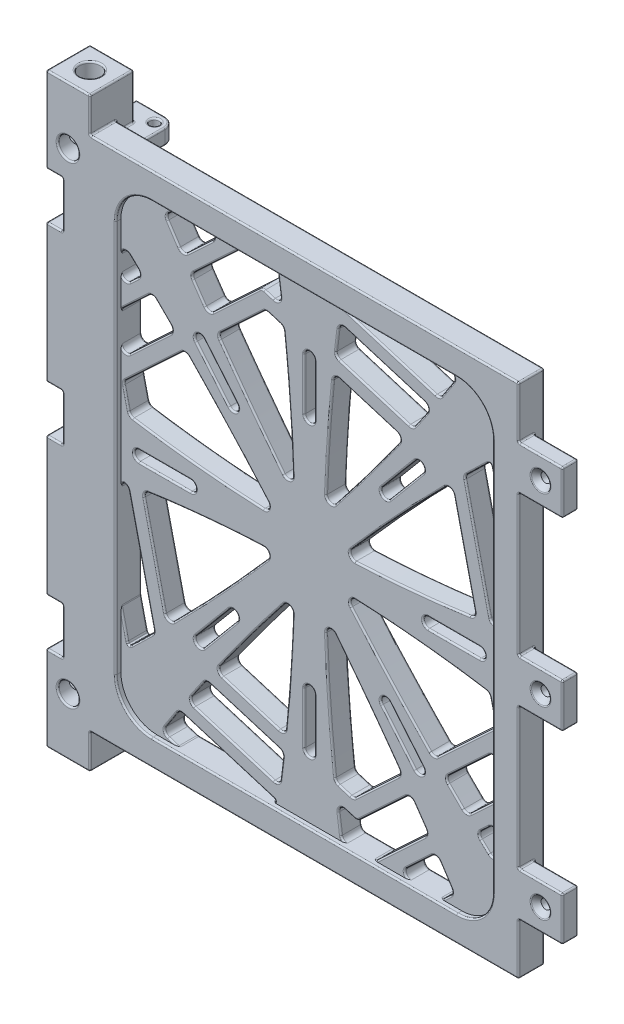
SolidWorks part; units mm, degrees
ref_plane "Front Plane" through (0, 0, 0) normal (0, 0, 1) x (1, 0, 0)
ref_plane "Top Plane" through (0, 0, 0) normal (0, 1, 0) x (1, 0, 0)
ref_plane "Right Plane" through (0, 0, 0) normal (1, 0, 0) x (0, 0, -1)
imported_body "Stock-cubesat - Master-1"
sketch "Sketch1" plane through (0, 0, 50) normal (0, 0, 1) x (1, 0, 0)
  line L1 (18.1879, 28.5582) -> (4.7082, 32.6747)
  line L2 (-8.4861, 36.704) -> (-17.801, 28.0122)
  line L3 (-36.0296, 11.0028) -> (-34.8308, 5.8177)
  line L4 (-18.1963, -28.5556) -> (-4.7082, -32.6747)
  line L5 (8.4861, -36.704) -> (17.8072, -28.0063)
  line L6 (36.0296, -11.0028) -> (34.8308, -5.8177)
  line L7 (-9.2664, 40.0791) -> (-19.5451, 30.4879)
  line L8 (-35.2057, -5.8787) -> (-30.0497, -28.1793)
  line L10 (9.2664, -40.0791) -> (19.5509, -30.4825)
  line L11 (35.2057, 5.8787) -> (30.0483, 28.1857)
  line L12 (35.1418, 32.7911) -> (34.8858, 32.8693)
  line L13 (-12.7874, 45) -> (-22.9852, 35.4843)
  line L14 (-36.5, -26.9164) -> (-35.1418, -32.7911)
  line L15 (-35.1418, -32.7911) -> (-34.8895, -32.8681)
  line L16 (12.7874, -45) -> (22.9898, -35.48)
  line L17 (-35.1418, -32.7911) -> (10.8271, -46.8292) construction
  line L19 (-25.3624, -45) -> (-6.24, -45)
  line L20 (-36.5, -26.9164) -> (-36.5, -6.0942)
  line L21 (-25.7161, 45) -> (-16.9223, 45)
  line L22 (36.5, -34.3959) -> (36.5, -26.7286)
  line L23 (-10.8271, 46.8292) -> (-45.9688, 14.0381) construction
  line L24 (35.1418, 32.7911) -> (-10.8271, 46.8292) construction
  line L26 (10.8271, -46.8292) -> (45.9688, -14.0381) construction
  line L27 (9.2664, -40.0791) -> (39.3427, -12.0146) construction
  line L28 (39.3427, -12.0146) -> (30.0763, 28.0645) construction
  line L29 (36.5, 26.9164) -> (35.1418, 32.7911)
  line L30 (45.9688, -14.0381) -> (35.1418, 32.7911) construction
  line L31 (-45.9688, 14.0381) -> (-35.1418, -32.7911) construction
  line L32 (-39.3427, 12.0146) -> (-30.0763, -28.0645) construction
  line L33 (-9.2664, 40.0791) -> (-39.3427, 12.0146) construction
  line L34 (-32.2342, -5.4132) -> (-27.5453, -25.6936)
  line L35 (-36.0296, 11.0028) -> (-27.5436, -25.7012) construction
  line L36 (-36.5, 14.6671) -> (-36.5, 22.8735)
  line L37 (32.2342, 5.4132) -> (27.5436, 25.7012)
  line L38 (36.0296, -11.0028) -> (27.5436, 25.7012) construction
  line L39 (36.5, 6.0942) -> (36.5, 26.9164)
  line L40 (24.0639, -22.1682) -> (36.0296, -11.0028)
  line L41 (8.4861, -36.704) -> (36.0296, -11.0028) construction
  line L42 (26.1676, -24.3084) -> (36.5, -14.6671)
  line L43 (30.4219, -28.5451) -> (36.5, -22.8735)
  line L44 (5.0334, -35.6496) -> (8.4861, -36.704)
  line L45 (-27.5436, -25.7012) -> (8.4861, -36.704) construction
  line L46 (5.4218, -38.905) -> (9.2664, -40.0791)
  line L47 (-30.0763, -28.0645) -> (9.2664, -40.0791) construction
  line L48 (6.24, -45) -> (12.7874, -45)
  line L49 (-20.0086, -31.139) -> (-5.0403, -35.71)
  line L50 (-23.5624, -36.3273) -> (-5.7895, -41.7548)
  line L51 (-30.4179, 28.5488) -> (-36.5, 22.8735)
  line L52 (-26.1624, 24.3132) -> (-36.5, 14.6671)
  line L53 (-24.0581, 22.1736) -> (-36.0296, 11.0028)
  line L54 (-8.4861, 36.704) -> (-36.0296, 11.0028) construction
  line L56 (-5.4218, 38.905) -> (-9.2664, 40.0791)
  line L57 (30.0763, 28.0645) -> (-9.2664, 40.0791) construction
  line L58 (-5.0334, 35.6496) -> (-8.4861, 36.704)
  line L59 (27.5436, 25.7012) -> (-8.4861, 36.704) construction
  line L60 (23.5565, 36.329) -> (5.7895, 41.7548)
  line L61 (20.001, 31.1413) -> (5.0403, 35.71)
  line L62 (-13.1261, 56.75) -> (-55.71, 17.0075) construction
  line L63 (-11.5648, 50) -> (-49.0837, 14.9846) construction
  line L64 (-25.7161, 45) -> (-27.9255, 42.938)
  line L65 (-16.9223, 45) -> (-24.5799, 37.8533)
  line L66 (16.9223, -45) -> (25.7161, -45)
  line L67 (-25.2007, -38.776) -> (-6.1802, -44.5827)
  line L68 (16.9223, -45) -> (24.5838, -37.8497)
  line L69 (13.1261, -56.75) -> (55.71, -17.0075) construction
  line L70 (25.1958, 38.7775) -> (6.1802, 44.5827)
  line L71 (36.5, -22.8735) -> (36.5, -14.6671)
  line L72 (-28.6184, -44.006) -> (-25.3624, -45)
  line L73 (25.7161, -45) -> (27.9279, -42.9358)
  line L74 (11.5648, -50) -> (49.0837, -14.9846) construction
  line L75 (28.6156, 44.0068) -> (25.3624, 45)
  line L76 (37.5189, 35.0154) -> (-11.5648, 50) construction
  line L77 (42.5839, 39.7425) -> (-13.1261, 56.75) construction
  line L78 (-37.5189, -35.0154) -> (11.5648, -50) construction
  line L79 (-42.5839, -39.7425) -> (13.1261, -56.75) construction
  line L80 (25.3624, 45) -> (6.24, 45)
  line L81 (55.71, -17.0075) -> (42.5839, 39.7425) construction
  line L82 (49.0837, -14.9846) -> (37.5189, 35.0154)
  line L83 (49.0837, -14.9846) -> (37.5189, 35.0154) construction
  line L84 (32.4422, -30.5157) -> (36.5, -26.7286)
  line L85 (-49.0837, 14.9846) -> (-37.5189, -35.0154)
  line L86 (-49.0837, 14.9846) -> (-37.5189, -35.0154) construction
  line L87 (-55.71, 17.0075) -> (-42.5839, -39.7425) construction
  line L88 (-36.5, 26.7286) -> (-36.5, 34.3995)
  line L89 (-32.4389, 30.5188) -> (-36.5, 26.7286)
  line L90 (-12.7874, 45) -> (-6.24, 45)
  spline S0 degree 3 poles (6.24, -45) (5.9474, -42.9683) (5.6747, -40.9366) (5.4218, -38.905) knots 0.05 0.05 0.05 0.05 0.11095 0.11095 0.11095 0.11095
  spline S1 degree 3 poles (-6.24, -45) (-6.22, -44.8609) (-6.2, -44.7218) (-6.1802, -44.5827) knots 0.05 0.05 0.05 0.05 0.054173 0.054173 0.054173 0.054173
  spline S2 degree 3 poles (34.8308, -5.8177) (25.4091, -4.2933) (15.9875, -3.3875) (6.5658, -3.1001) knots 0.080352 0.080352 0.080352 0.080352 0.420894 0.420894 0.420894 0.420894
  spline S3 degree 3 poles (26.1676, -24.3084) (27.5748, -25.7297) (28.9928, -27.142) (30.4219, -28.5451) knots 0.817381 0.817381 0.817381 0.817381 0.869043 0.869043 0.869043 0.869043
  spline S4 degree 3 poles (28.6156, 44.0068) (27.4875, 42.2539) (26.3475, 40.5108) (25.1958, 38.7775) knots 0.060746 0.060746 0.060746 0.060746 0.114386 0.114386 0.114386 0.114386
  spline S5 degree 3 poles (34.8858, 32.8693) (33.2595, 31.3195) (31.647, 29.7583) (30.0483, 28.1857) knots 0.077551 0.077551 0.077551 0.077551 0.135404 0.135404 0.135404 0.135404
  spline S6 degree 3 poles (3.1169, 8.5481) (3.3369, 16.5903) (3.8673, 24.6325) (4.7082, 32.6747) knots 0.585481 0.585481 0.585481 0.585481 0.826747 0.826747 0.826747 0.826747
  spline S7 degree 3 poles (-6.5497, 3.0996) (-15.9767, 3.3864) (-25.4038, 4.2925) (-34.8308, 5.8177) knots 0.578912 0.578912 0.578912 0.578912 0.919648 0.919648 0.919648 0.919648
  spline S8 degree 3 poles (-3.1169, 8.5481) (-3.364, 17.582) (-4.0029, 26.6158) (-5.0334, 35.6496) knots 0.585481 0.585481 0.585481 0.585481 0.856496 0.856496 0.856496 0.856496
  spline S9 degree 3 poles (-6.5658, -3.1001) (-15.1219, -3.3611) (-23.678, -4.1321) (-32.2342, -5.4132) knots 0.579106 0.579106 0.579106 0.579106 0.888364 0.888364 0.888364 0.888364
  spline S10 degree 3 poles (-3.1164, -8.5284) (-8.3357, -15.0438) (-13.3623, -21.7196) (-18.1963, -28.5556) knots 0.562618 0.562618 0.562618 0.562618 0.779016 0.779016 0.779016 0.779016
  spline S11 degree 3 poles (-6.5658, -3.1001) (-13.2687, -10.873) (-20.2619, -18.4041) (-27.5453, -25.6936) knots 0.568139 0.568139 0.568139 0.568139 0.834199 0.834199 0.834199 0.834199
  spline S12 degree 3 poles (6.5658, -3.1001) (12.1938, -9.6265) (18.0265, -15.9826) (24.0639, -22.1682) knots 0.568139 0.568139 0.568139 0.568139 0.791535 0.791535 0.791535 0.791535
  spline S13 degree 3 poles (3.1164, -8.5284) (8.1958, -14.8692) (13.0928, -21.3618) (17.8072, -28.0063) knots 0.562618 0.562618 0.562618 0.562618 0.773216 0.773216 0.773216 0.773216
  spline S14 degree 3 poles (-36.5, 34.3995) (-35.1367, 33.1139) (-33.783, 31.8203) (-32.4389, 30.5188) knots 0.058463 0.058463 0.058463 0.058463 0.106691 0.106691 0.106691 0.106691
  spline S15 degree 3 poles (-27.9255, 42.938) (-26.8215, 41.2338) (-25.7063, 39.5389) (-24.5799, 37.8533) knots 0.07166 0.07166 0.07166 0.07166 0.123929 0.123929 0.123929 0.123929
  spline S16 degree 3 poles (36.5, 6.0942) (36.0686, 6.0211) (35.6371, 5.9492) (35.2057, 5.8787) knots 0.060241 0.060241 0.060241 0.060241 0.075835 0.075835 0.075835 0.075835
  spline S17 degree 3 poles (19.5509, -30.4825) (20.7084, -32.139) (21.8547, -33.8049) (22.9898, -35.48) knots 0.799303 0.799303 0.799303 0.799303 0.851511 0.851511 0.851511 0.851511
  spline S18 degree 3 poles (5.0334, -35.6496) (4.0021, -26.6092) (3.3631, -17.5688) (3.1164, -8.5284) knots 0.143504 0.143504 0.143504 0.143504 0.414716 0.414716 0.414716 0.414716
  spline S19 degree 3 poles (-4.7082, -32.6747) (-3.8666, -24.6259) (-3.336, -16.5771) (-3.1164, -8.5284) knots 0.173253 0.173253 0.173253 0.173253 0.414716 0.414716 0.414716 0.414716
  spline S20 degree 3 poles (-20.0086, -31.139) (-21.2052, -32.8584) (-22.3898, -34.5878) (-23.5624, -36.3273) knots 0.806194 0.806194 0.806194 0.806194 0.860304 0.860304 0.860304 0.860304
  spline S21 degree 3 poles (-30.0497, -28.1793) (-31.6493, -29.7537) (-33.2625, -31.3166) (-34.8895, -32.8681) knots 0.864556 0.864556 0.864556 0.864556 0.922459 0.922459 0.922459 0.922459
  spline S22 degree 3 poles (-35.2057, -5.8787) (-35.6371, -5.9492) (-36.0686, -6.0211) (-36.5, -6.0942) knots 0.924165 0.924165 0.924165 0.924165 0.939759 0.939759 0.939759 0.939759
  spline S23 degree 3 poles (-24.0581, 22.1736) (-18.0165, 15.9866) (-12.1803, 9.6286) (-6.5497, 3.0996) knots 0.208454 0.208454 0.208454 0.208454 0.431942 0.431942 0.431942 0.431942
  spline S24 degree 3 poles (-17.801, 28.0122) (-13.0879, 21.3729) (-8.1933, 14.8849) (-3.1169, 8.5481) knots 0.226773 0.226773 0.226773 0.226773 0.437237 0.437237 0.437237 0.437237
  spline S25 degree 3 poles (-5.4218, 38.905) (-5.6747, 40.9366) (-5.9474, 42.9683) (-6.24, 45) knots 0.88905 0.88905 0.88905 0.88905 0.95 0.95 0.95 0.95
  spline S26 degree 3 poles (5.0403, 35.71) (5.2706, 37.7249) (5.5203, 39.7399) (5.7895, 41.7548) knots 0.8571 0.8571 0.8571 0.8571 0.917548 0.917548 0.917548 0.917548
  spline S27 degree 3 poles (18.1879, 28.5582) (13.356, 21.7286) (8.3323, 15.0585) (3.1169, 8.5481) knots 0.221007 0.221007 0.221007 0.221007 0.437237 0.437237 0.437237 0.437237
  spline S28 degree 3 poles (27.5436, 25.7012) (20.2541, 18.4099) (13.2561, 10.876) (6.5497, 3.0996) knots 0.165754 0.165754 0.165754 0.165754 0.431942 0.431942 0.431942 0.431942
  spline S29 degree 3 poles (32.2342, 5.4132) (23.6727, 4.1313) (15.1112, 3.3601) (6.5497, 3.0996) knots 0.111636 0.111636 0.111636 0.111636 0.421088 0.421088 0.421088 0.421088
  spline S30 degree 3 poles (23.5565, 36.329) (22.3834, 34.5898) (21.1982, 32.8605) (20.001, 31.1413) knots 0.139712 0.139712 0.139712 0.139712 0.193826 0.193826 0.193826 0.193826
  spline S31 degree 3 poles (6.1802, 44.5827) (6.2, 44.7218) (6.22, 44.8609) (6.24, 45) knots 0.945827 0.945827 0.945827 0.945827 0.95 0.95 0.95 0.95
  spline S32 degree 3 poles (24.5838, -37.8497) (25.7098, -39.5357) (26.8245, -41.2311) (27.9279, -42.9358) knots 0.876064 0.876064 0.876064 0.876064 0.928336 0.928336 0.928336 0.928336
  spline S33 degree 3 poles (-5.7895, -41.7548) (-5.5203, -39.7399) (-5.2706, -37.7249) (-5.0403, -35.71) knots 0.082452 0.082452 0.082452 0.082452 0.1429 0.1429 0.1429 0.1429
  spline S34 degree 3 poles (-25.2007, -38.776) (-26.3517, -40.5095) (-27.491, -42.2528) (-28.6184, -44.006) knots 0.885627 0.885627 0.885627 0.885627 0.939262 0.939262 0.939262 0.939262
  spline S35 degree 3 poles (32.4422, -30.5157) (33.7853, -31.817) (35.1379, -33.1104) (36.5, -34.3959) knots 0.893302 0.893302 0.893302 0.893302 0.941511 0.941511 0.941511 0.941511
  spline S36 degree 3 poles (-30.4179, 28.5488) (-28.9884, 27.1461) (-27.5699, 25.7342) (-26.1624, 24.3132) knots 0.130949 0.130949 0.130949 0.130949 0.182609 0.182609 0.182609 0.182609
  spline S37 degree 3 poles (-22.9852, 35.4843) (-21.8497, 33.8095) (-20.703, 32.1441) (-19.5451, 30.4879) knots 0.148481 0.148481 0.148481 0.148481 0.200686 0.200686 0.200686 0.200686
  point P43 (0, 0)
extrude "Cut-Extrude1" cut sketch "Sketch1" against normal blind 5
fillet "Fillet1" radius 1 92 edges at (-16.9223, 45, 47.5) (-5.0334, 35.6496, 47.5) (-6.24, 45, 47.5) (-27.9255, 42.938, 47.5) (-22.9852, 35.4843, 47.5) (5.0403, 35.71, 47.5) (6.1802, 44.5827, 47.5) (6.24, 45, 47.5) (26.1676, -24.3084, 47.5) (32.4422, -30.5157, 47.5) (17.8072, -28.0063, 47.5) (22.9898, -35.48, 47.5) (27.9279, -42.9358, 47.5) (9.2664, -40.0791, 47.5) (-25.2007, -38.776, 47.5) (-27.5453, -25.6936, 47.5) (-35.1418, -32.7911, 47.5) (-34.8895, -32.8681, 47.5) (-5.7895, -41.7548, 47.5) (-4.7082, -32.6747, 47.5) (36.5, -22.8735, 47.5) (24.0639, -22.1682, 47.5) (30.4219, -28.5451, 47.5) (36.5, -34.3959, 47.5) (25.7161, -45, 47.5) (12.7874, -45, 47.5) (8.4861, -36.704, 47.5) (-5.4218, 38.905, 47.5) (20.001, 31.1413, 47.5) (25.1958, 38.7775, 47.5) (36.0296, -11.0028, 47.5) (32.2342, 5.4132, 47.5) (36.5, 6.0942, 47.5) (35.2057, 5.8787, 47.5) (-36.5, 14.6671, 47.5) (-36.5, 26.7286, 47.5) (-32.4389, 30.5188, 47.5) (-26.1624, 24.3132, 47.5) (-17.801, 28.0122, 47.5) (-24.5799, 37.8533, 47.5) (-19.5451, 30.4879, 47.5) (-9.2664, 40.0791, 47.5) (-34.8308, 5.8177, 47.5) (-36.5, -26.9164, 47.5) (-25.3624, -45, 47.5) (-28.6184, -44.006, 47.5) (6.24, -45, 47.5) (16.9223, -45, 47.5) (5.0334, -35.6496, 47.5) (-18.1963, -28.5556, 47.5) (-23.5624, -36.3273, 47.5) (-20.0086, -31.139, 47.5) (-6.24, -45, 47.5) (-6.1802, -44.5827, 47.5) (-5.0403, -35.71, 47.5) (18.1879, 28.5582, 47.5) (23.5565, 36.329, 47.5) (28.6156, 44.0068, 47.5) (25.3624, 45, 47.5) (27.5436, 25.7012, 47.5) (36.5, 26.9164, 47.5) (35.1418, 32.7911, 47.5) (34.8858, 32.8693, 47.5) (34.8308, -5.8177, 47.5) (36.5, -14.6671, 47.5) (36.5, -26.7286, 47.5) (24.5838, -37.8497, 47.5) (19.5509, -30.4825, 47.5) (5.7895, 41.7548, 47.5) (-32.2342, -5.4132, 47.5) (-36.5, -6.0942, 47.5) (-36.0296, 11.0028, 47.5) (-36.5, 22.8735, 47.5) (-30.4179, 28.5488, 47.5) (-36.5, 34.3995, 47.5) (-25.7161, 45, 47.5) (-12.7874, 45, 47.5) (4.7082, 32.6747, 47.5) (-8.4861, 36.704, 47.5) (-24.0581, 22.1736, 47.5) (3.1164, -8.5284, 47.5) (6.5497, 3.0996, 47.5) (3.1169, 8.5481, 47.5) (-3.1169, 8.5481, 47.5) (-6.5497, 3.0996, 47.5) (-3.1164, -8.5284, 47.5) (-6.5658, -3.1001, 47.5) (6.5658, -3.1001, 47.5) (5.4218, -38.905, 47.5) (-35.2057, -5.8787, 47.5) (30.0483, 28.1857, 47.5) (-30.0497, -28.1793, 47.5)
fillet "Fillet5" radius 0.3 2 edges at (6.4482, 44.7521, 47.5) (-6.4482, -44.7521, 47.5)
sketch "Sketch4" plane through (0, 0, 50) normal (0, 0, 1) x (1, 0, 0)
  line L0 (-19.4594, 45) -> (-25.322, 45) construction
  line L1 (36.5, -45) -> (-36.5, -45)
  line L2 (36.5, -45) -> (36.5, 45)
  line L3 (36.5, 45) -> (-36.5, 45)
  line L4 (-36.5, -45) -> (-36.5, 45)
  line L5 (36.5, -45) -> (-36.5, 45) construction
  line L6 (36.5, 45) -> (-36.5, -45) construction
  line L7 (-36.5, -6.9406) -> (-36.5, -26.8023) construction
  point P0 (0, 0)
extrude "Cut-Extrude3" cut sketch "Sketch4" against normal blind 1
fillet "Fillet4" radius 7 4 edges at (-36.5, -45, 49.5) (36.5, -45, 49.5) (36.5, 45, 49.5) (-36.5, 45, 49.5)
fillet "Fillet3" radius 0.3 152 edges at (-39.5, -45, 45) (-39.5, 45, 45) (-42.25, -45, 37.5) (-38.0858, -45, 38.0858) (-42.25, 45, 37.5) (-38.0858, 45, 38.0858) (-48.4, -31.25, 50) (-48.4, -4.5, 50) (-48.4, 4.5, 50) (-48.4, 31.25, 50) (-48.4, 40.25, 50) (-48.4, -40.25, 50) (43.85, 35.75, 50) (43.85, 0, 50) (43.85, -35.75, 50) (-47.75, -45.75, 50) (-47.75, 45.75, 50) (-36.5, 0, 50) (36.5, 0, 50) (0, -45, 50) (0, 45, 50) (-39.5, -48, 40.4) (-42.25, -48, 37.5) (-45, -48, 39.5) (-39.5, -48, 45) (-38.0858, -48, 38.0858) (-39.5, 48, 45) (-45, 48, 39.5) (-42.25, 48, 37.5) (-38.0858, 48, 38.0858) (-39.5, 48, 40.4) (-41.5, 45, 43.25) (-41.5, -45, 43.25) (-41.5, 0, 45) (-41.5, 49, 45) (-41.5, -49, 45) (-41.5, 48, 43.25) (-37.5, -46.5, 45) (-37.5, -45, 42.25) (-37.5, -48, 42.25) (-37.5, 45, 42.25) (-37.5, 46.5, 45) (-37.5, 48, 42.25) (-43.25, 45, 41.5) (-45, 46.5, 41.5) (-43.25, 48, 41.5) (-41.5, 0, 41.5) (-41.5, -52.375, 41.5) (-41.5, 52.375, 41.5) (-48.4, 40.25, 41.5) (-48.4, 31.25, 41.5) (-48.4, 4.5, 41.5) (-48.4, -4.5, 41.5) (-48.4, -31.25, 41.5) (-48.4, -40.25, 41.5) (-43.25, -48, 41.5) (-45, -46.5, 41.5) (-43.25, -45, 41.5) (-41.5, -48, 43.25) (0, -50, 45) (45.75, 31.5, 47) (45.75, -4.25, 47) (45.75, -4.25, 50) (45.75, -40, 47) (45.75, -40, 50) (45.75, -31.5, 47) (45.75, -31.5, 50) (50, -31.5, 48.5) (50, -35.75, 47) (50, -40, 48.5) (50, -35.75, 50) (45.75, 4.25, 47) (45.75, 4.25, 50) (50, 4.25, 48.5) (50, 0, 47) (50, -4.25, 48.5) (50, 0, 50) (50, 35.75, 47) (50, 31.5, 48.5) (50, 35.75, 50) (45.75, 40, 47) (50, 40, 48.5) (41.5, 4.25, 48.5) (41.5, 35.75, 47) (41.5, 0, 45) (41.5, -50, 47.5) (41.5, -40, 48.5) (41.5, -35.75, 47) (41.5, -31.5, 48.5) (41.5, -4.25, 48.5) (41.5, 0, 47) (0, 50, 45) (41.5, 50, 47.5) (-45.75, -56.75, 50) (-41.5, -56.75, 45.75) (-45.75, -56.75, 41.5) (-45.75, -56.75, 47.75) (-50, -56.75, 45.75) (-50, -48.5, 41.5) (-50, -17.875, 41.5) (-50, 17.875, 41.5) (-50, 48.5, 41.5) (-50, -40.25, 45.75) (-50, -48.5, 50) (-50, 48.5, 50) (-50, 17.875, 50) (-50, -17.875, 50) (-50, -45.75, 43.75) (-46.8, -40.25, 45.75) (-46.8, -35.75, 41.5) (-46.8, -31.25, 45.75) (-46.8, -35.75, 50) (-46.8, -35.75, 46.65) (-50, -4.5, 45.75) (-50, -31.25, 45.75) (-46.8, -4.5, 45.75) (-46.8, 0, 41.5) (-46.8, 4.5, 45.75) (-46.8, 0, 50) (-46.8, 0, 44.85) (-46.8, 31.25, 45.75) (-46.8, 35.75, 41.5) (-46.8, 40.25, 45.75) (-46.8, 35.75, 50) (-46.8, 35.75, 46.65) (-50, 4.5, 45.75) (-50, 31.25, 45.75) (-50, 40.25, 45.75) (-50, 45.75, 47.75) (-45.75, 56.75, 41.5) (-41.5, 56.75, 45.75) (-45.75, 56.75, 50) (-50, 56.75, 45.75) (-45.75, 56.75, 47.75) (34.4497, -42.9497, 50) (34.4497, 42.9497, 50) (-34.4497, 42.9497, 50) (-34.4497, -42.9497, 50)
fillet "Fillet6" radius 0.3 11 edges at (6.8956, 44.3707, 45) (-33.6503, 25.5326, 45) (-35.8817, 10.9577, 45) (-35.8817, 10.9577, 49) (-34.6901, 5.9672, 49) (3.8682, 10.5954, 49) (36.4936, 26.9157, 49) (27.2499, 24.6761, 45) (19.496, -31.0063, 49) (-25.1174, -39.0092, 45)
sketch "Sketch3" plane through (0, 0, 50) normal (0, 0, 1) x (1, 0, 0)
  line L0 (-33, 0) -> (-23, 0) construction
  line L1 (-33, 1) -> (-23, 1)
  line L2 (-33, -1) -> (-23, -1)
  line L3 (-28, 0) -> (0, 0) construction
  line L4 (0, 0) -> (-9.9558, -9.9558) construction
  line L5 (0, 0) -> (0, -11.4326) construction
  line L6 (0, 0) -> (-13.4359, -6.2653) construction
  line L7 (-21.212, -25.2795) -> (-14.7841, -17.619) construction
  line L8 (-20.4459, -25.9223) -> (-14.0181, -18.2618)
  line L9 (-21.978, -24.6367) -> (-15.5502, -16.9762)
  line L10 (0, -33) -> (0, -23) construction
  line L11 (1, -33) -> (1, -23)
  line L12 (-1, -33) -> (-1, -23)
  line L13 (0, 0) -> (7.4428, -7.4428) construction
  line L14 (33, 0) -> (23, 0) construction
  line L15 (33, -1) -> (23, -1)
  line L16 (33, 1) -> (23, 1)
  line L17 (0, 33) -> (0, 23) construction
  line L18 (-1, 33) -> (-1, 23)
  line L19 (1, 33) -> (1, 23)
  line L20 (0, 0) -> (-4.2429, 4.2429) construction
  line L21 (-21.212, 25.2795) -> (-14.7841, 17.619) construction
  line L22 (-20.4459, 25.9223) -> (-14.0181, 18.2618)
  line L23 (-21.978, 24.6367) -> (-15.5502, 16.9762)
  line L24 (21.212, -25.2795) -> (14.7841, -17.619) construction
  line L25 (20.4459, -25.9223) -> (14.0181, -18.2618)
  line L26 (21.978, -24.6367) -> (15.5502, -16.9762)
  line L27 (21.212, 25.2795) -> (14.7841, 17.619) construction
  line L28 (20.4459, 25.9223) -> (14.0181, 18.2618)
  line L29 (21.978, 24.6367) -> (15.5502, 16.9762)
  arc A0 (-33, 1) -> (-33, -1) centre (-33, 0) ccw
  arc A1 (-23, -1) -> (-23, 1) centre (-23, 0) ccw
  arc A2 (-20.4459, -25.9223) -> (-21.978, -24.6367) centre (-21.212, -25.2795) cw
  arc A3 (-15.5502, -16.9762) -> (-14.0181, -18.2618) centre (-14.7841, -17.619) cw
  arc A4 (1, -33) -> (-1, -33) centre (0, -33) cw
  arc A5 (-1, -23) -> (1, -23) centre (0, -23) cw
  arc A6 (33, -1) -> (33, 1) centre (33, 0) ccw
  arc A7 (23, 1) -> (23, -1) centre (23, 0) ccw
  arc A8 (-1, 33) -> (1, 33) centre (0, 33) cw
  arc A9 (1, 23) -> (-1, 23) centre (0, 23) cw
  arc A10 (-20.4459, 25.9223) -> (-21.978, 24.6367) centre (-21.212, 25.2795) ccw
  arc A11 (-15.5502, 16.9762) -> (-14.0181, 18.2618) centre (-14.7841, 17.619) ccw
  arc A12 (20.4459, -25.9223) -> (21.978, -24.6367) centre (21.212, -25.2795) ccw
  arc A13 (15.5502, -16.9762) -> (14.0181, -18.2618) centre (14.7841, -17.619) ccw
  arc A14 (20.4459, 25.9223) -> (21.978, 24.6367) centre (21.212, 25.2795) cw
  arc A15 (15.5502, 16.9762) -> (14.0181, 18.2618) centre (14.7841, 17.619) cw
  point P3 (-28, 0)
  point P15 (-17.9981, -21.4492)
  point P22 (0, -28)
  point P30 (28, 0)
  point P37 (0, 28)
  point P45 (-17.9981, 21.4492)
  point P52 (17.9981, -21.4492)
  point P59 (17.9981, 21.4492)
  dimension "D1" = 28
extrude "Cut-Extrude2" cut sketch "Sketch3" against normal blind 10
fillet "Fillet7" radius 0.3 64 edges at (18.7641, 20.8065, 45) (14.1413, 16.853, 45) (17.232, 22.092, 45) (18.7641, 20.8065, 49) (14.1413, 16.853, 49) (17.232, 22.092, 49) (0, 22, 45) (-1, 28, 45) (0, 34, 45) (0, 22, 49) (-1, 28, 49) (0, 34, 49) (-14.1413, 16.853, 45) (-18.7641, 20.8065, 45) (-21.8548, 26.0455, 45) (-14.1413, 16.853, 49) (-18.7641, 20.8065, 49) (-21.8548, 26.0455, 49) (-17.232, -22.092, 45) (-21.8548, -26.0455, 45) (-18.7641, -20.8065, 45) (-17.232, -22.092, 49) (-21.8548, -26.0455, 49) (-18.7641, -20.8065, 49) (21.8548, -26.0455, 45) (17.232, -22.092, 45) (14.1413, -16.853, 45) (21.8548, -26.0455, 49) (17.232, -22.092, 49) (14.1413, -16.853, 49) (34, 0, 45) (28, -1, 45) (22, 0, 45) (34, 0, 49) (28, -1, 49) (22, 0, 49) (0, -34, 45) (-1, -28, 45) (0, -22, 45) (0, -34, 49) (-1, -28, 49) (0, -22, 49) (-22, 0, 45) (-28, -1, 45) (-34, 0, 45) (-22, 0, 49) (-28, -1, 49) (-34, 0, 49) (21.8548, 26.0455, 45) (21.8548, 26.0455, 49) (1, 28, 45) (1, 28, 49) (-17.232, 22.092, 45) (-17.232, 22.092, 49) (-14.1413, -16.853, 45) (-14.1413, -16.853, 49) (18.7641, -20.8065, 45) (18.7641, -20.8065, 49) (28, 1, 45) (28, 1, 49) (1, -28, 45) (1, -28, 49) (-28, 1, 45) (-28, 1, 49)
